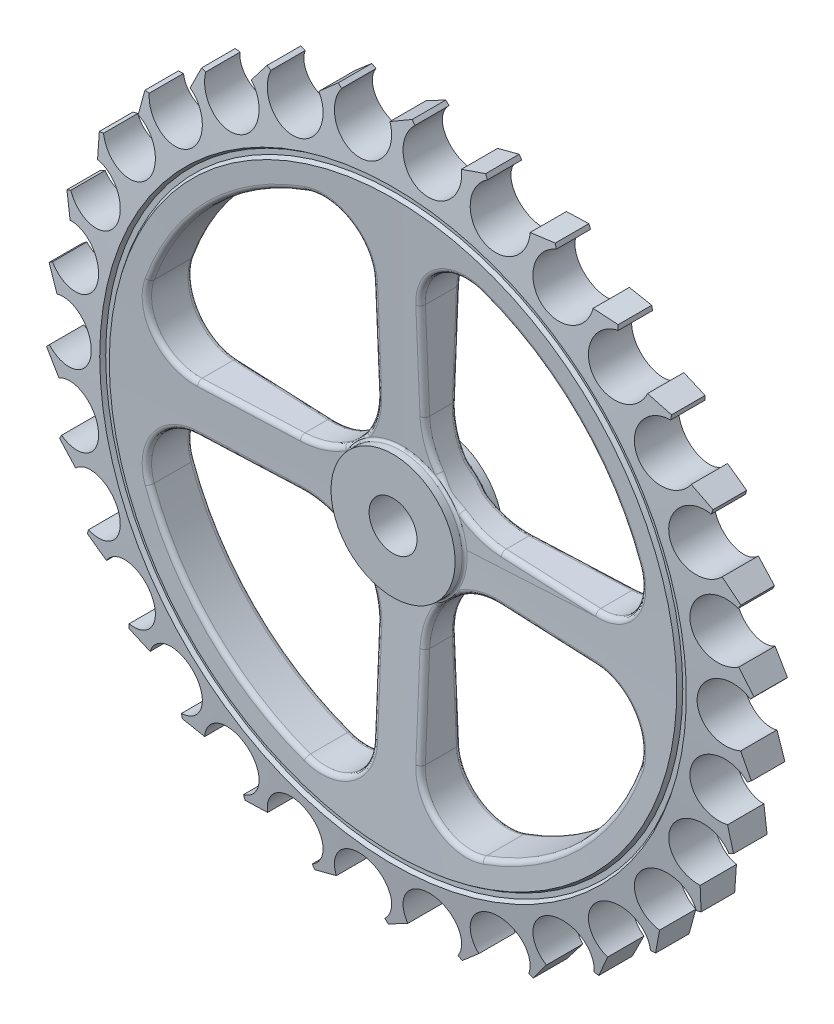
SolidWorks part; units mm, degrees
ref_plane "Front Plane" through (0, 0, 0) normal (0, 0, 1) x (1, 0, 0)
ref_plane "Top Plane" through (0, 0, 0) normal (0, 1, 0) x (1, 0, 0)
ref_plane "Right Plane" through (0, 0, 0) normal (1, 0, 0) x (0, 0, -1)
sketch "Sketch1" plane through (0, 0, 0) normal (1, 0, 0) x (0, 0, -1)
  line L0 (5, 0) -> (-5, 0)
  line L1 (3.5, 73.99) -> (-3.5, 73.99)
  line L2 (-5, 12.95) -> (-5, 0)
  line L3 (-5, 0) -> (-4.9655, -0.0016)
  line L4 (-3.5, 73.99) -> (-5, 61.215)
  line L5 (-4.25, 60.715) -> (-4.25, 59.715)
  line L6 (-5, 61.215) -> (-4.25, 60.715)
  line L7 (-4.25, 59.715) -> (-5, 59.215)
  line L8 (-3.5211, 12.95) -> (-5, 12.95)
  line L9 (3.5, 73.99) -> (5, 61.215)
  line L10 (5, 12.95) -> (-5, 12.95) construction
  line L11 (5, 61.215) -> (4.25, 60.715)
  line L12 (4.25, 60.715) -> (4.25, 59.715)
  line L13 (4.25, 59.715) -> (5, 59.215)
  line L14 (-5, 59.215) -> (-3.0216, 13.4707)
  line L15 (5, 59.215) -> (3.0216, 13.4707)
  line L17 (3.5211, 12.95) -> (5, 12.95)
  line L18 (5, 12.95) -> (5, 0)
  arc A0 (-3.0216, 13.4707) -> (-3.5211, 12.95) centre (-3.5211, 13.45) cw
  arc A1 (3.0216, 13.4707) -> (3.5211, 12.95) centre (3.5211, 13.45) ccw
  point P4 (0, 0)
  point P8 (0, 73.99)
  point P16 (-3, 12.95)
  point P18 (-3, 12.95)
  dimension "D5" = 0.5
  dimension "D1" = 10
  dimension "D2" = 73.99
  dimension "D3" = 7
  dimension "D4" = 0
  dimension "D7" = 0.75
  dimension "D8" = 1
  dimension "D9" = 0.5
  dimension "D11" = 2
  dimension "D10" = 12.95
revolve "Revolve2" add sketch "Sketch1" angle 360 about L0
sketch "Sketch4" plane through (0, 0, 0) normal (0, 0, 1) x (1, 0, 0)
  line L0 (0, 0) -> (6.6078, 62.8687)
  line L1 (0, 0) -> (0, 93.5928)
  line L2 (0, 0) -> (-6.6078, 62.8687)
  line L3 (2.4978, 73.9478) -> (-1.8717, 71.5258)
  line L4 (2.4978, 73.9478) -> (3.1342, 73.2158)
  line L5 (17.8178, 71.8126) -> (13.0402, 70.3519)
  line L6 (17.8178, 71.8126) -> (18.2881, 70.9642)
  line L7 (32.3591, 66.5388) -> (27.3823, 66.1033)
  line L8 (32.3591, 66.5388) -> (32.6427, 65.6111)
  line L9 (45.4862, 58.3569) -> (40.5275, 58.9657)
  line L10 (45.4862, 58.3569) -> (45.5707, 57.3906)
  line L11 (56.6253, 47.6245) -> (51.9016, 49.251)
  line L12 (56.6253, 47.6245) -> (56.5071, 46.6618)
  line L13 (65.2896, 34.8108) -> (61.0073, 37.3838)
  line L14 (65.2896, 34.8108) -> (64.9738, 33.8936)
  line L15 (71.1004, 20.4756) -> (67.4467, 23.8828)
  line L16 (71.1004, 20.4756) -> (70.6008, 19.6441)
  line L17 (73.8038, 5.2455) -> (70.9383, 9.3379)
  line L18 (73.8038, 5.2455) -> (73.1423, 4.5361)
  line L19 (73.2816, -10.2138) -> (71.3296, -5.615)
  line L20 (73.2816, -10.2138) -> (72.4871, -10.7701)
  line L21 (69.5567, -25.2267) -> (68.6034, -20.3226)
  line L22 (69.5567, -25.2267) -> (68.6638, -25.6057)
  line L23 (62.7918, -39.1371) -> (62.879, -34.1419)
  line L24 (62.7918, -39.1371) -> (61.8396, -39.3222)
  line L25 (53.2826, -51.337) -> (54.4064, -46.4691)
  line L26 (53.2826, -51.337) -> (52.3127, -51.3201)
  line L27 (41.4447, -61.2932) -> (43.556, -56.7654)
  line L28 (41.4447, -61.2932) -> (40.4995, -61.075)
  line L29 (27.7954, -68.5706) -> (30.802, -64.5808)
  line L30 (27.7954, -68.5706) -> (26.9163, -68.1607)
  line L31 (12.9314, -72.8512) -> (16.7019, -69.5736)
  line L32 (12.9314, -72.8512) -> (12.1567, -72.2675)
  line L33 (-2.4978, -73.9478) -> (1.8717, -71.5258)
  line L34 (-2.4978, -73.9478) -> (-3.1342, -73.2158)
  line L35 (-17.8178, -71.8126) -> (-13.0402, -70.3519)
  line L36 (-17.8178, -71.8126) -> (-18.2881, -70.9642)
  line L37 (-32.3591, -66.5388) -> (-27.3823, -66.1033)
  line L38 (-32.3591, -66.5388) -> (-32.6427, -65.6111)
  line L39 (-45.4862, -58.3569) -> (-40.5275, -58.9657)
  line L40 (-45.4862, -58.3569) -> (-45.5707, -57.3906)
  line L41 (-56.6253, -47.6245) -> (-51.9016, -49.251)
  line L42 (-56.6253, -47.6245) -> (-56.5071, -46.6618)
  line L43 (-65.2896, -34.8108) -> (-61.0073, -37.3838)
  line L44 (-65.2896, -34.8108) -> (-64.9738, -33.8936)
  line L45 (-71.1004, -20.4756) -> (-67.4467, -23.8828)
  line L46 (-71.1004, -20.4756) -> (-70.6008, -19.6441)
  line L47 (-73.8038, -5.2455) -> (-70.9383, -9.3379)
  line L48 (-73.8038, -5.2455) -> (-73.1423, -4.5361)
  line L49 (-73.2816, 10.2138) -> (-71.3296, 5.615)
  line L50 (-73.2816, 10.2138) -> (-72.4871, 10.7701)
  line L51 (-69.5567, 25.2267) -> (-68.6034, 20.3226)
  line L52 (-69.5567, 25.2267) -> (-68.6638, 25.6057)
  line L53 (-62.7918, 39.1371) -> (-62.879, 34.1419)
  line L54 (-62.7918, 39.1371) -> (-61.8396, 39.3222)
  line L55 (-53.2826, 51.337) -> (-54.4064, 46.4691)
  line L56 (-53.2826, 51.337) -> (-52.3127, 51.3201)
  line L57 (-41.4447, 61.2932) -> (-43.556, 56.7654)
  line L58 (-41.4447, 61.2932) -> (-40.4995, 61.075)
  line L59 (-27.7954, 68.5706) -> (-30.802, 64.5808)
  line L60 (-27.7954, 68.5706) -> (-26.9163, 68.1607)
  line L61 (-12.9314, 72.8512) -> (-16.7019, 69.5736)
  line L62 (-12.9314, 72.8512) -> (-12.1567, 72.2675)
  arc A0 (6.6078, 62.8687) -> (13.0402, 70.3519) centre (7.2349, 68.8358) ccw
  circle A1 centre (0, 0) radius 73.99 construction
  arc A2 (-6.6078, 62.8687) -> (-1.8717, 71.5258) centre (-7.2349, 68.8358) ccw
  arc A3 (3.1342, 73.2158) -> (6.6078, 62.8687) centre (7.2349, 68.8358) ccw
  arc A4 (18.2881, 70.9642) -> (19.5345, 60.121) centre (21.3886, 65.8274) ccw
  arc A5 (19.5345, 60.121) -> (27.3823, 66.1033) centre (21.3886, 65.8274) ccw
  arc A6 (32.6427, 65.6111) -> (31.6075, 54.7458) centre (34.6075, 59.9419) ccw
  arc A7 (31.6075, 54.7458) -> (40.5275, 58.9657) centre (34.6075, 59.9419) ccw
  arc A8 (45.5707, 57.3906) -> (42.2991, 46.9779) centre (46.3139, 51.4368) ccw
  arc A9 (42.2991, 46.9779) -> (51.9016, 49.251) centre (46.3139, 51.4368) ccw
  arc A10 (56.5071, 46.6618) -> (51.142, 37.1568) centre (55.9961, 40.6836) ccw
  arc A11 (51.142, 37.1568) -> (61.0073, 37.3838) centre (55.9961, 40.6836) ccw
  arc A12 (64.9738, 33.8936) -> (57.7498, 25.7119) centre (63.231, 28.1523) ccw
  arc A13 (57.7498, 25.7119) -> (67.4467, 23.8828) centre (63.231, 28.1523) ccw
  arc A14 (70.6008, 19.6441) -> (61.8336, 13.1431) centre (67.7025, 14.3906) ccw
  arc A15 (61.8336, 13.1431) -> (70.9383, 9.3379) centre (67.7025, 14.3906) ccw
  arc A16 (73.1423, 4.5361) -> (63.215, 0) centre (69.215, 0) ccw
  arc A17 (63.215, 0) -> (71.3296, -5.615) centre (69.215, 0) ccw
  arc A18 (72.4871, -10.7701) -> (61.8336, -13.1431) centre (67.7025, -14.3906) ccw
  arc A19 (61.8336, -13.1431) -> (68.6034, -20.3226) centre (67.7025, -14.3906) ccw
  arc A20 (68.6638, -25.6057) -> (57.7498, -25.7119) centre (63.231, -28.1523) ccw
  arc A21 (57.7498, -25.7119) -> (62.879, -34.1419) centre (63.231, -28.1523) ccw
  arc A22 (61.8396, -39.3222) -> (51.142, -37.1568) centre (55.9961, -40.6836) ccw
  arc A23 (51.142, -37.1568) -> (54.4064, -46.4691) centre (55.9961, -40.6836) ccw
  arc A24 (52.3127, -51.3201) -> (42.2991, -46.9779) centre (46.3139, -51.4368) ccw
  arc A25 (42.2991, -46.9779) -> (43.556, -56.7654) centre (46.3139, -51.4368) ccw
  arc A26 (40.4995, -61.075) -> (31.6075, -54.7458) centre (34.6075, -59.9419) ccw
  arc A27 (31.6075, -54.7458) -> (30.802, -64.5808) centre (34.6075, -59.9419) ccw
  arc A28 (26.9163, -68.1607) -> (19.5345, -60.121) centre (21.3886, -65.8274) ccw
  arc A29 (19.5345, -60.121) -> (16.7019, -69.5736) centre (21.3886, -65.8274) ccw
  arc A30 (12.1567, -72.2675) -> (6.6078, -62.8687) centre (7.2349, -68.8358) ccw
  arc A31 (6.6078, -62.8687) -> (1.8717, -71.5258) centre (7.2349, -68.8358) ccw
  arc A32 (-3.1342, -73.2158) -> (-6.6078, -62.8687) centre (-7.2349, -68.8358) ccw
  arc A33 (-6.6078, -62.8687) -> (-13.0402, -70.3519) centre (-7.2349, -68.8358) ccw
  arc A34 (-18.2881, -70.9642) -> (-19.5345, -60.121) centre (-21.3886, -65.8274) ccw
  arc A35 (-19.5345, -60.121) -> (-27.3823, -66.1033) centre (-21.3886, -65.8274) ccw
  arc A36 (-32.6427, -65.6111) -> (-31.6075, -54.7458) centre (-34.6075, -59.9419) ccw
  arc A37 (-31.6075, -54.7458) -> (-40.5275, -58.9657) centre (-34.6075, -59.9419) ccw
  arc A38 (-45.5707, -57.3906) -> (-42.2991, -46.9779) centre (-46.3139, -51.4368) ccw
  arc A39 (-42.2991, -46.9779) -> (-51.9016, -49.251) centre (-46.3139, -51.4368) ccw
  arc A40 (-56.5071, -46.6618) -> (-51.142, -37.1568) centre (-55.9961, -40.6836) ccw
  arc A41 (-51.142, -37.1568) -> (-61.0073, -37.3838) centre (-55.9961, -40.6836) ccw
  arc A42 (-64.9738, -33.8936) -> (-57.7498, -25.7119) centre (-63.231, -28.1523) ccw
  arc A43 (-57.7498, -25.7119) -> (-67.4467, -23.8828) centre (-63.231, -28.1523) ccw
  arc A44 (-70.6008, -19.6441) -> (-61.8336, -13.1431) centre (-67.7025, -14.3906) ccw
  arc A45 (-61.8336, -13.1431) -> (-70.9383, -9.3379) centre (-67.7025, -14.3906) ccw
  arc A46 (-73.1423, -4.5361) -> (-63.215, 0) centre (-69.215, 0) ccw
  arc A47 (-63.215, 0) -> (-71.3296, 5.615) centre (-69.215, 0) ccw
  arc A48 (-72.4871, 10.7701) -> (-61.8336, 13.1431) centre (-67.7025, 14.3906) ccw
  arc A49 (-61.8336, 13.1431) -> (-68.6034, 20.3226) centre (-67.7025, 14.3906) ccw
  arc A50 (-68.6638, 25.6057) -> (-57.7498, 25.7119) centre (-63.231, 28.1523) ccw
  arc A51 (-57.7498, 25.7119) -> (-62.879, 34.1419) centre (-63.231, 28.1523) ccw
  arc A52 (-61.8396, 39.3222) -> (-51.142, 37.1568) centre (-55.9961, 40.6836) ccw
  arc A53 (-51.142, 37.1568) -> (-54.4064, 46.4691) centre (-55.9961, 40.6836) ccw
  arc A54 (-52.3127, 51.3201) -> (-42.2991, 46.9779) centre (-46.3139, 51.4368) ccw
  arc A55 (-42.2991, 46.9779) -> (-43.556, 56.7654) centre (-46.3139, 51.4368) ccw
  arc A56 (-40.4995, 61.075) -> (-31.6075, 54.7458) centre (-34.6075, 59.9419) ccw
  arc A57 (-31.6075, 54.7458) -> (-30.802, 64.5808) centre (-34.6075, 59.9419) ccw
  arc A58 (-26.9163, 68.1607) -> (-19.5345, 60.121) centre (-21.3886, 65.8274) ccw
  arc A59 (-19.5345, 60.121) -> (-16.7019, 69.5736) centre (-21.3886, 65.8274) ccw
  arc A60 (-12.1567, 72.2675) -> (-6.6078, 62.8687) centre (-7.2349, 68.8358) ccw
  circle A61 centre (0, 0) radius 73.99
  point P217 (0, 0)
  dimension "D1" = 30
  dimension "D4" = 12
  dimension "D2" = 6
  dimension "D3" = 6
  dimension "D5" = 125
  dimension "D6" = 0.97
  dimension "D7" = 102
extrude "Cut-Extrude1" cut sketch "Sketch4" against normal through all both and the other way through all contours L49 A61 L48 A46 A47 | L51 A61 L50 A48 A49 | L53 A61 L52 A50 A51 | L55 A61 L54 A52 A53 | L57 A61 L56 A54 A55 | L59 A61 L58 A56 A57 | L61 A61 L60 A58 A59 | L1 A61 L62 A60 A2 L3 | L5 A61 L4 A3 A0 | L7 A61 L6 A4 A5 | L9 A61 L8 A6 A7 | L11 A61 L10 A8 A9 | L13 A61 L12 A10 A11 | L15 A61 L14 A12 A13 | L17 A61 L16 A14 A15 | L19 A61 L18 A16 A17 | L21 A61 L20 A18 A19 | L23 A61 L22 A20 A21 | L25 A61 L24 A22 A23 | L27 A61 L26 A24 A25 | L29 A61 L28 A26 A27 | L31 A61 L30 A28 A29 | L33 A61 L32 A30 A31 | L35 A61 L34 A32 A33 | L37 A61 L36 A34 A35 | L39 A61 L38 A36 A37 | L41 A61 L40 A38 A39 | L43 A61 L42 A40 A41 | L45 A61 L44 A42 A43 | L47 A61 L46 A44 A45 | L3 A61 L1
sketch "Sketch5" plane through (0, 0, 0) normal (0, 0, 1) x (1, 0, 0)
  line L0 (21, -5) -> (41.5929, -5)
  line L1 (5, -21) -> (5, -41.5929)
  line L2 (5, 21) -> (5, 41.5929)
  line L3 (21, 5) -> (41.5929, 5)
  line L4 (-5, -21) -> (-5, -41.5929)
  line L5 (-21, -5) -> (-41.5929, -5)
  line L6 (-21, 5) -> (-41.5929, 5)
  line L7 (-5, 21) -> (-5, 41.5929)
  arc A1 (41.5929, 5) -> (50.9998, 18.3925) centre (41.5929, 15) ccw
  arc A2 (5, 41.5929) -> (18.3925, 50.9998) centre (15, 41.5929) cw
  arc A3 (5, 21) -> (21, 5) centre (21, 21) ccw
  arc A4 (50.9998, 18.3925) -> (18.3925, 50.9998) centre (0, 0) ccw
  arc A5 (41.5929, -5) -> (50.9998, -18.3925) centre (41.5929, -15) cw
  arc A6 (18.3925, -50.9998) -> (50.9998, -18.3925) centre (0, 0) ccw
  arc A7 (5, -41.5929) -> (18.3925, -50.9998) centre (15, -41.5929) ccw
  arc A8 (21, -5) -> (5, -21) centre (21, -21) ccw
  arc A9 (-5, -41.5929) -> (-18.3925, -50.9998) centre (-15, -41.5929) cw
  arc A10 (-50.9998, -18.3925) -> (-18.3925, -50.9998) centre (0, 0) ccw
  arc A11 (-41.5929, -5) -> (-50.9998, -18.3925) centre (-41.5929, -15) ccw
  arc A12 (-5, -21) -> (-21, -5) centre (-21, -21) ccw
  arc A13 (-41.5929, 5) -> (-50.9998, 18.3925) centre (-41.5929, 15) cw
  arc A14 (-18.3925, 50.9998) -> (-50.9998, 18.3925) centre (0, 0) ccw
  arc A15 (-5, 41.5929) -> (-18.3925, 50.9998) centre (-15, 41.5929) ccw
  arc A16 (-21, 5) -> (-5, 21) centre (-21, 21) ccw
  point P40 (0, 0)
  dimension "D1" = 10
  dimension "D2" = 16
  dimension "D3" = 4
extrude "Cut-Extrude2" cut sketch "Sketch5" against normal through all both and the other way through all
fillet "Fillet1" radius 1 48 edges at (-49.4598, 8.8266, -4.6119) (-38.3358, 38.3358, -4.7838) (-9.707, 50.0772, -4.6451) (-10.9193, 8.575, -3.0394) (-8.575, -10.9193, -3.0394) (-8.8266, -49.4598, -4.6119) (-38.3358, -38.3358, -4.7838) (-50.0772, -9.707, -4.6451) (49.4598, -8.8266, -4.6119) (38.3358, -38.3358, -4.7838) (9.707, -50.0772, -4.6451) (10.9193, -8.575, -3.0394) (8.575, 10.9193, -3.0394) (8.8266, 49.4598, -4.6119) (38.3358, 38.3358, -4.7838) (50.0772, 9.707, -4.6451) (8.575, 10.9193, 3.0394) (8.8266, 49.4598, 4.6119) (38.3358, 38.3358, 4.7838) (50.0772, 9.707, 4.6451) (10.9193, -8.575, 3.0394) (49.4598, -8.8266, 4.6119) (38.3358, -38.3358, 4.7838) (9.707, -50.0772, 4.6451) (-8.8266, -49.4598, 4.6119) (-38.3358, -38.3358, 4.7838) (-50.0772, -9.707, 4.6451) (-8.575, -10.9193, 3.0394) (-49.4598, 8.8266, 4.6119) (-38.3358, 38.3358, 4.7838) (-9.707, 50.0772, 4.6451) (-10.9193, 8.575, 3.0394)
sketch "Sketch6" plane through (0, 0, 5) normal (0, 0, 1) x (1, 0, 0)
  circle A0 centre (0, 0) radius 5
  dimension "D1" = 10
extrude "Cut-Extrude3" cut sketch "Sketch6" against normal through all
